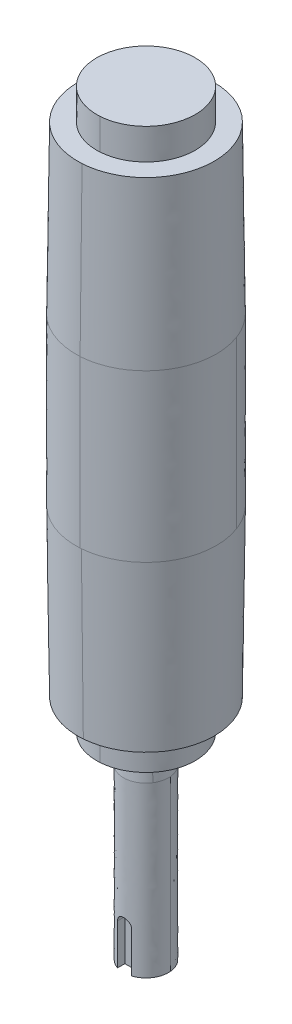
SolidWorks part; units mm, degrees
ref_plane "Plan de face" through (0, 0, 0) normal (0, 0, 1) x (1, 0, 0)
ref_plane "Plan de dessus" through (0, 0, 0) normal (0, 1, 0) x (1, 0, 0)
ref_plane "Plan de droite" through (0, 0, 0) normal (1, 0, 0) x (0, 0, -1)
imported_body "Importée1"
sketch "Esquisse1" plane through (0, 190.5, 0) normal (0, 1, 0) x (-1, 0, 0)
  line L0 (-1.0683, 17.4674) -> (2.0656, -17.3777) construction
  circle A0 centre (0.4986, 0.0448) radius 5.13
sketch "Esquisse2" plane through (0, -118.5, 0) normal (0, -1, 0) x (1, 0, 0)
  line L0 (6.9997, -0.0611) -> (-6.9459, 0.8689) construction
  circle A0 centre (0.0269, 0.4039) radius 3.7097
sketch "Esquisse3" plane through (0, -118.5, 0) normal (0, -1, 0) x (1, 0, 0)
  circle A0 centre (0, 0) radius 9
  dimension "D1" = 18
extrude "Enlèv. mat.-Extru.1" cut sketch "Esquisse3" against normal blind 40
